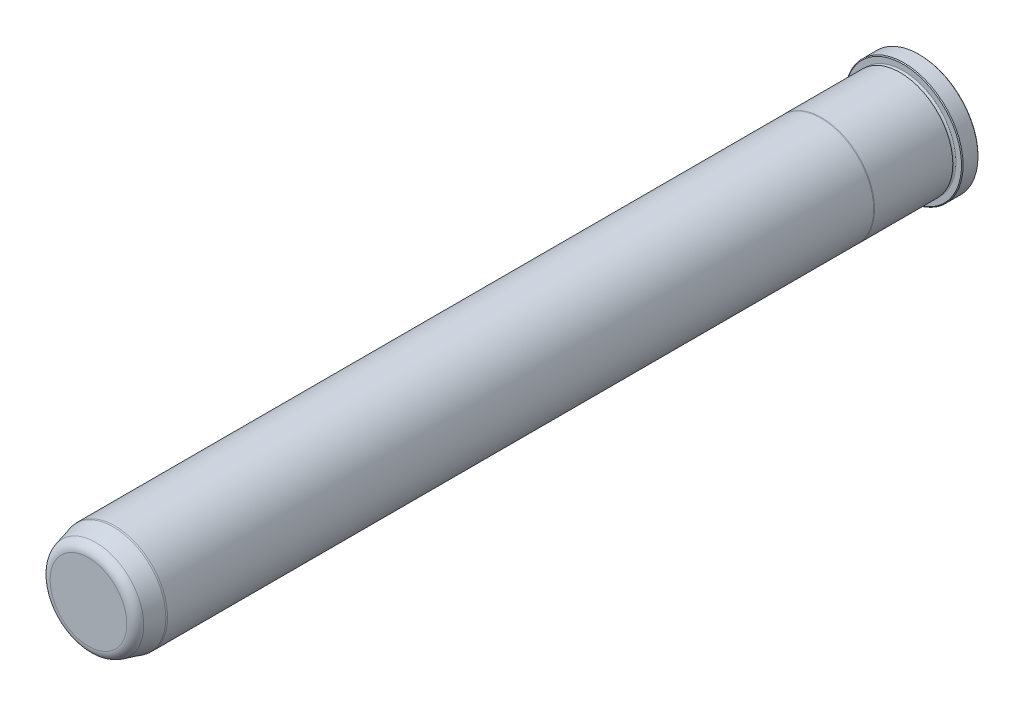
SolidWorks part; units mm, degrees
ref_plane "Front Plane" through (0, 0, 0) normal (0, 0, 1) x (1, 0, 0)
ref_plane "Top Plane" through (0, 0, 0) normal (0, 1, 0) x (1, 0, 0)
ref_plane "Right Plane" through (0, 0, 0) normal (1, 0, 0) x (0, 0, -1)
sketch "Sketch1" plane through (0, 0, 0) normal (1, 0, 0) x (0, 0, -1)
  line L0 (0, 0) -> (0, 28.448)
  line L1 (0, 28.448) -> (-7.9248, 28.448)
  line L2 (-7.9248, 28.448) -> (-7.9248, 25.3873)
  line L3 (-7.9248, 24.6253) -> (-9.4488, 24.6253) construction
  line L4 (-9.4488, 25.3873) -> (-9.4488, 25.4127)
  line L5 (-9.4488, 25.4127) -> (-47.1348, 25.4127)
  line L6 (-47.1348, 25.4127) -> (-47.498, 25.3873)
  line L7 (-47.498, 25.3873) -> (-387.35, 25.3873)
  line L9 (-400.05, 22.1219) -> (-400.05, 0)
  line L10 (-400.05, 0) -> (0, 0)
  line L11 (0, 0) -> (13.6287, 0) construction
  line L12 (-387.35, 25.3873) -> (-388.112, 25.3206)
  line L13 (-388.112, 25.3206) -> (-400.05, 22.1219)
  arc A0 (-9.4488, 25.3873) -> (-7.9248, 25.3873) centre (-8.6868, 25.3873) ccw
  dimension "D14" = 1.524
  dimension "D1" = 7.9248
  dimension "D2" = 1.524
  dimension "D3" = 56.896
  dimension "D4" = 50.8254
  dimension "D5" = 47.498
  dimension "D6" = 400.05
  dimension "D7" = 0.7874
  dimension "D8" = 4
  dimension "D9" = 50.7746
  dimension "D10" = 5
  dimension "D11" = 15
  dimension "D12" = 0.762
  dimension "D13" = 12.7
revolve "Revolve1" add sketch "Sketch1" angle 360 about L11
fillet "Fillet6" radius 4.7625 1 edges at (22.1219, 0, 400.05)
chamfer "Chamfer1" distance 0.381 angle 45 2 edges at (28.448, 0, 0) (28.448, 0, 7.9248)
